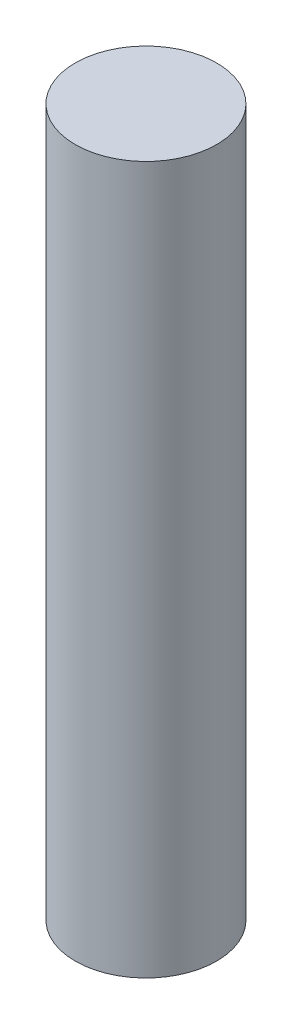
SolidWorks part; units mm, degrees
ref_plane "Plan de face" through (0, 0, 0) normal (0, 0, 1) x (1, 0, 0)
ref_plane "Plan de dessus" through (0, 0, 0) normal (0, 1, 0) x (1, 0, 0)
ref_plane "Plan de droite" through (0, 0, 0) normal (1, 0, 0) x (0, 0, -1)
sketch "Esquisse1" plane through (0, 0, 0) normal (0, 1, 0) x (1, 0, 0)
  circle A0 centre (0, 0) radius 0.7
  dimension "D1" = 1.4
extrude "Boss.-Extru.1" add sketch "Esquisse1" along normal blind 7
